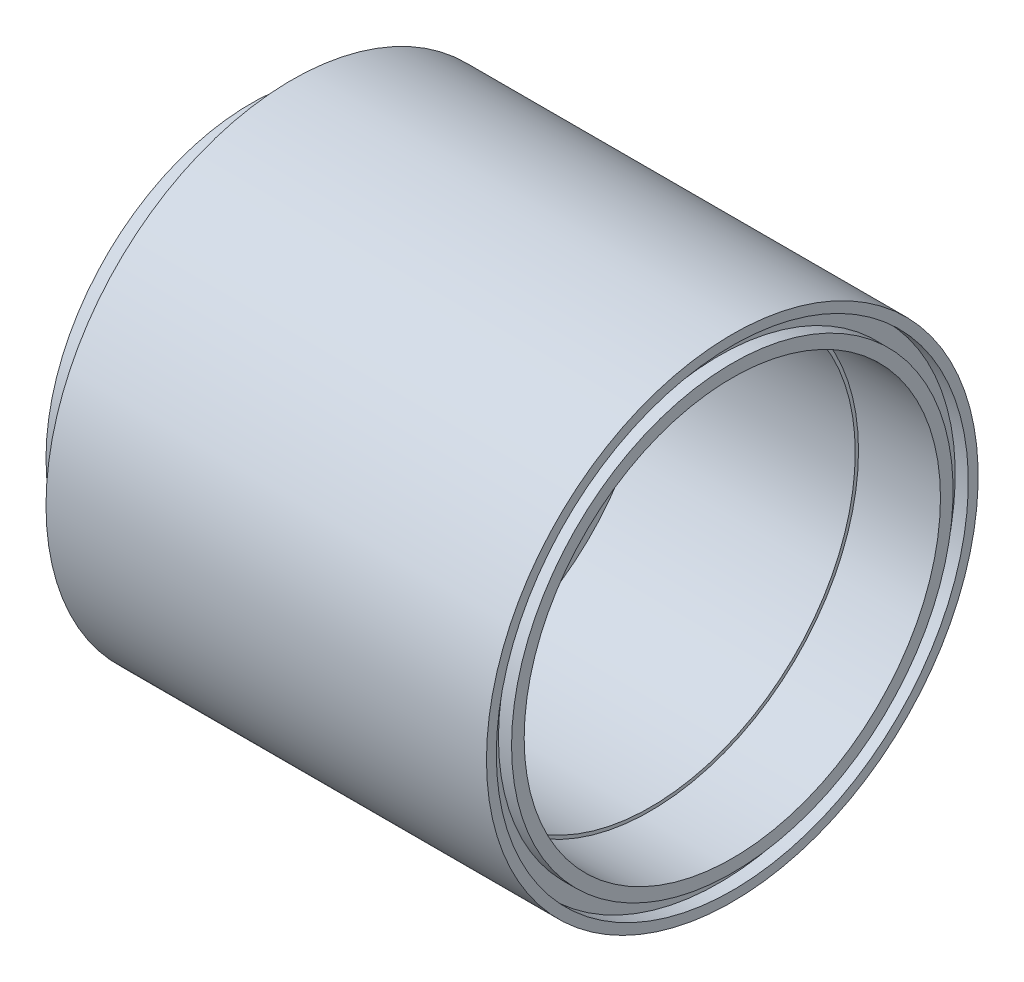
SolidWorks part; units mm, degrees
ref_plane "Front" through (0, 0, 0) normal (0, 0, 1) x (1, 0, 0)
ref_plane "Top" through (0, 0, 0) normal (0, 1, 0) x (1, 0, 0)
ref_plane "Right" through (0, 0, 0) normal (1, 0, 0) x (0, 0, -1)
sketch "Sketch1" plane through (0, 0, 0) normal (0, 0, 1) x (1, 0, 0)
  line L0 (-23.8125, 38.1) -> (-23.8125, 31.75)
  line L1 (-23.8125, 31.75) -> (-30.1625, 31.75)
  line L2 (-30.1625, 31.75) -> (-30.1625, 28.8925)
  line L3 (-30.1625, 28.8925) -> (-11.1125, 28.8925)
  line L4 (-11.1125, 28.8925) -> (-11.1125, 22.86)
  line L5 (-4.7625, 0) -> (0, 0)
  line L6 (0, 0) -> (0, 31.75)
  line L7 (0, 31.75) -> (-6.35, 31.75)
  line L8 (-6.35, 31.75) -> (-6.35, 38.1)
  line L9 (-6.35, 38.1) -> (-23.8125, 38.1)
  line L10 (-11.1125, 22.86) -> (-4.7625, 22.86)
  line L11 (-4.7625, 22.86) -> (-4.7625, 0)
  line L12 (-11.1125, 25.4) -> (-9.4615, 25.4)
  line L13 (-9.4615, 25.4) -> (-9.4615, 27.051)
  line L14 (-9.4615, 27.051) -> (-11.1125, 27.051)
  line L15 (-6.35, 38.1) -> (44.45, 38.1)
  line L16 (44.45, 38.1) -> (44.45, 36.576)
  line L17 (44.45, 36.576) -> (42.418, 36.576)
  line L18 (42.418, 36.576) -> (42.418, 34.2138)
  line L19 (42.418, 34.2138) -> (44.45, 34.2138)
  line L20 (44.45, 34.2138) -> (44.45, 32.258)
  line L21 (44.45, 32.258) -> (31.75, 32.258)
  line L22 (31.75, 32.258) -> (31.75, 31.75)
  line L23 (31.75, 31.75) -> (0, 31.75)
  dimension "D1" = 28.8925
  dimension "D2" = 19.05
  dimension "D3" = 6.35
  dimension "D4" = 4.7625
  dimension "D5" = 31.75
  dimension "D6" = 6.35
  dimension "D7" = 31.75
  dimension "D8" = 38.1
  dimension "D9" = 22.86
  dimension "D10" = 6.35
  dimension "D11" = 1.651
  dimension "D12" = 1.651
  dimension "D13" = 2.54
  dimension "D14" = 68.2625
  dimension "D15" = 32.258
  dimension "D16" = 12.7
  dimension "D17" = 36.576
  dimension "D18" = 2.3622
  dimension "D19" = 2.032
revolve "Revolve1" add sketch "Sketch1" angle 360 about L5
sketch "Sketch2" plane through (-4.7625, 0, 0) normal (-1, 0, 0) x (0, 0, 1)
  line L0 (-8.509, 0) -> (8.509, 0) construction
  line L1 (0, 6.35) -> (0, 0) construction
  circle A0 centre (-8.509, 0) radius 1.778
  circle A1 centre (8.509, 0) radius 1.778
  circle A2 centre (0, 6.35) radius 2.54
  dimension "D1" = 3.556
  dimension "D4" = 5.08
  dimension "D2" = 17.018
  dimension "D3" = 6.35
extrude "Cut-Extrude1" cut sketch "Sketch2" against normal up to next
hole_wizard "#2-56 Tapped Hole1" positions "Sketch4" profile "Sketch3" tap size "#2-56" standard "ANSI Inch"
sketch "Sketch4" plane through (0, 0, 0) normal (1, 0, 0) x (0, 0, -1)
  circle A0 centre (0, 0) radius 23.114
  point P6 (0, 23.114)
  point P8 (23.114, 0)
  point P10 (0, -23.114)
  point P12 (-23.114, 0)
  dimension "D1" = 46.228
sketch "Sketch3" plane through (0, 23.114, 0) normal (0, 1, 0) x (0, 0, -1)
  line L0 (0, 0) -> (0, 4.318)
  line L1 (0, 4.318) -> (0.889, 4.318)
  line L2 (0.889, 4.318) -> (0.889, 0)
  line L5 (0.889, 0) -> (0, 0)
  line L10 (0, 4.318) -> (-0.889, 4.318) construction
  line L11 (0, -6.35) -> (0, 107.95) construction
  dimension "Tap Drill Dia." = 1.778
  dimension "Tap Drill Depth" = 4.318
  dimension "Drill Angle" = 180
